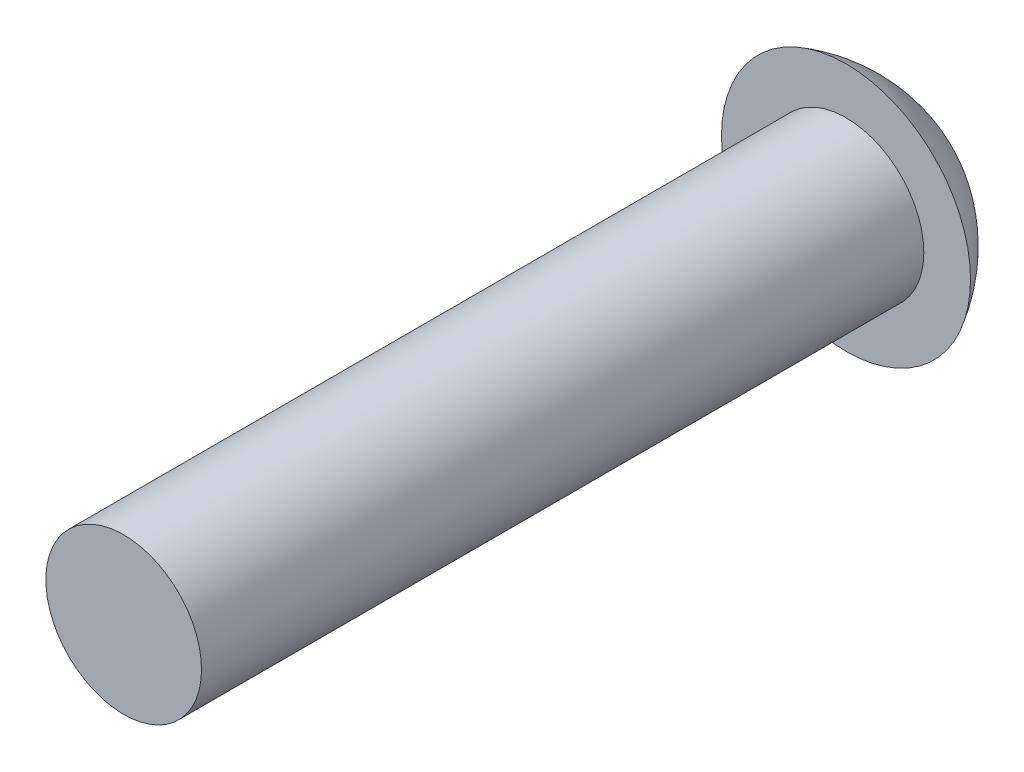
SolidWorks part; units mm, degrees
ref_plane "前视基准面" through (0, 0, 0) normal (0, 0, 1) x (1, 0, 0)
ref_plane "上视基准面" through (0, 0, 0) normal (0, 1, 0) x (1, 0, 0)
ref_plane "右视基准面" through (0, 0, 0) normal (1, 0, 0) x (0, 0, -1)
sketch "草图1" plane through (0, 0, 0) normal (0, 0, 1) x (1, 0, 0)
  circle A0 centre (0, 0) radius 2.5
  dimension "D1" = 5
extrude "凸台-拉伸1" add sketch "草图1" along normal mid plane 23.2
sketch "草图3" plane through (0, 0, 0) normal (0, 1, 0) x (1, 0, 0)
  line L0 (0, 11.6) -> (0, 14.1)
  line L1 (2.5, 11.6) -> (-2.5, 11.6) construction
  line L2 (0, 11.6) -> (-4, 11.6)
  arc A0 (0, 14.1) -> (-4, 11.6) centre (0.3367, 9.1113) ccw
  dimension "D3" = 5
  dimension "D1" = 4
  dimension "D2" = 2.5
revolve "旋转1" add sketch "草图3" angle 360 about L0
sketch "草图4" plane through (0, 0, 0) normal (1, 0, 0) x (0, 0, -1)
  line L0 (-5, 0) -> (5, 0) construction
  line L1 (-5, 1) -> (5, 1)
  line L2 (-5, -1) -> (5, -1)
  arc A0 (-5, 1) -> (-5, -1) centre (-5, 0) ccw
  arc A1 (5, -1) -> (5, 1) centre (5, 0) ccw
  point P2 (0, 0)
  dimension "D2" = 1
  dimension "D1" = 10
extrude "切除-拉伸1" cut sketch "草图4" against normal blind 22 from offset 1.5
